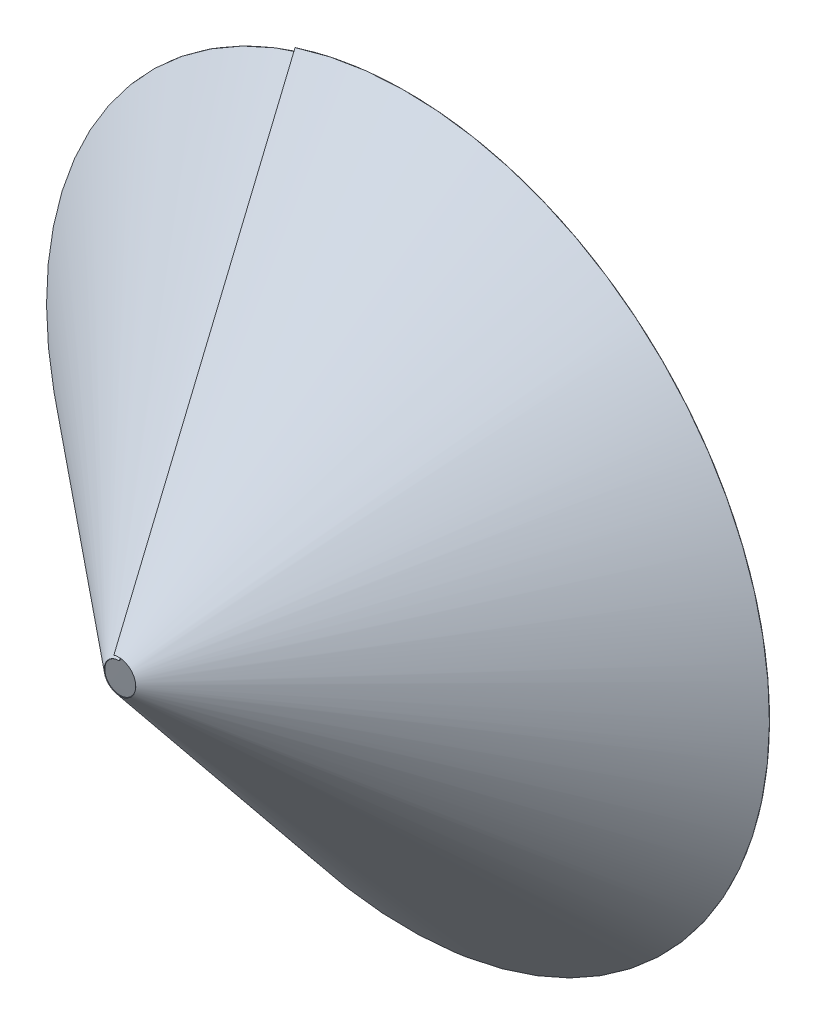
SolidWorks part; units mm, degrees
ref_plane "Ebene vorne" through (0, 0, 0) normal (0, 0, 1) x (1, 0, 0)
ref_plane "Ebene oben" through (0, 0, 0) normal (0, 1, 0) x (1, 0, 0)
ref_plane "Ebene rechts" through (0, 0, 0) normal (1, 0, 0) x (0, 0, -1)
ref_plane "Ebene1" through (0, 0, 200) normal (0, 0, 1) x (1, 0, 0)
sketch "Skizze13" plane through (0, 0, 0) normal (0, 0, 1) x (1, 0, 0)
  circle A0 centre (0, 0) radius 250
  dimension "D1" = 500
curve "Spirale/Helix1"
sketch "Skizze14" plane through (0, 0, 200) normal (0, 0, 1) x (1, 0, 0)
  circle A0 centre (0, 0) radius 10
  dimension "D1" = 20
curve "Spirale/Helix2"
sketch "Skizze15" plane through (0, 0, 0) normal (0, 0, 1) x (1, 0, 0)
  spline S0 degree 3 number of poles 130 (0, 250) -> (-77.9032, 239.7613) construction
  spline S1 degree 3 number of poles 130 (0, 250) -> (-77.9032, 239.7613)
sketch "Skizze16" plane through (0, 0, 200) normal (0, 0, 1) x (1, 0, 0)
  spline S0 degree 3 poles (-1838.2029, -762.5312) (132.984, -154.1024) (30.0415, 22.9394) (-5.3534, 8.7642) (-6.5464, 7.9723) (-8.5256, 5.9601) (-9.3107, 4.7407) (-10.3295, 2.0699) (-10.5624, 0.6198) (-10.4227, -2.2714) (-10.0498, -3.711) (-8.7461, -6.3356) (-7.8158, -7.5193) (-5.5412, -9.4239) (-4.1979, -10.1437) (-1.3158, -10.9862) (0.2217, -11.1083) (3.2355, -10.7196) (4.7103, -10.2087) (7.3461, -8.6253) (8.5058, -7.5534) (10.3062, -5.0164) (10.946, -3.5525) (11.5851, -0.4711) (11.584, 1.145) (10.9263, 4.2593) (10.2699, 5.7561) (8.3974, 8.3746) (7.1822, 9.495) (4.3859, 11.1613) (2.806, 11.7063) (-39.227, 16.9779) (-111.0825, -186.4561) (1912.1211, -536.6373) knots -1.585477 -1.585477 -1.585477 -1.585477 0.0625 0.0625 0.125 0.125 0.1875 0.1875 0.25 0.25 0.3125 0.3125 0.375 0.375 0.4375 0.4375 0.5 0.5 0.5625 0.5625 0.625 0.625 0.6875 0.6875 0.75 0.75 0.8125 0.8125 0.875 0.875 0.9375 0.9375 2.483898 2.483898 2.483898 2.483898 only from (0, 10) to (-3.7391, 11.5078) construction
  spline S1 degree 3 poles (0, 10) (-1.3744, 10.0437) (-2.7668, 9.8001) (-5.3534, 8.7642) (-6.5464, 7.9723) (-8.5256, 5.9601) (-9.3107, 4.7407) (-10.3295, 2.0699) (-10.5624, 0.6198) (-10.4227, -2.2714) (-10.0498, -3.711) (-8.7461, -6.3356) (-7.8158, -7.5193) (-5.5412, -9.4239) (-4.1979, -10.1437) (-1.3158, -10.9862) (0.2217, -11.1083) (3.2355, -10.7196) (4.7103, -10.2087) (7.3461, -8.6253) (8.5058, -7.5534) (10.3062, -5.0164) (10.946, -3.5525) (11.5851, -0.4711) (11.584, 1.145) (10.9263, 4.2593) (10.2699, 5.7561) (8.3974, 8.3746) (7.1822, 9.495) (4.3859, 11.1613) (2.806, 11.7063) (-0.4597, 12.1159) (-2.1439, 11.9801) (-3.7391, 11.5078) knots 0 0 0 0 0.0625 0.0625 0.125 0.125 0.1875 0.1875 0.25 0.25 0.3125 0.3125 0.375 0.375 0.4375 0.4375 0.5 0.5 0.5625 0.5625 0.625 0.625 0.6875 0.6875 0.75 0.75 0.8125 0.8125 0.875 0.875 0.9375 0.9375 1 1 1 1
sheet metal parameters "Blech3" thickness 0.3 parameters "D1"=10
lofted bend "Ausgeformte Biegungen3" thickness 0.3 parameters "D1"=0
other "Freiform-Biegung4" parameters "D1"=1000, "D4"=57.296, "D5"=1
flat pattern "Abwicklung2"
sketch "Biegung-Linien2" plane through (-31.6907, 98.3395, 123.9833) normal (-0.1964, 0.6093, 0.7682) x (0.9805, 0.122, 0.1538)
  line L0 (-290.8119, -94.4871) -> (19.667, -129.169) construction
  line L1 (-47.1298, 187.8466) -> (28.5063, -115.2691) construction
sketch3d "Rahmen2" [suppressed]
  line L0 (629.4747, 16.0526, 0) -> (202.5843, -478.5492, 0) construction
  line L1 (179.132, 404.743, 0) -> (-247.7584, -89.8588, 0) construction
  line L2 (629.4747, 16.0526, 0) -> (179.132, 404.743, 0) construction
  line L3 (202.5843, -478.5492, 0) -> (-247.7584, -89.8588, 0) construction
other "Abwickeln-<Freiform-Biegung4>1"
